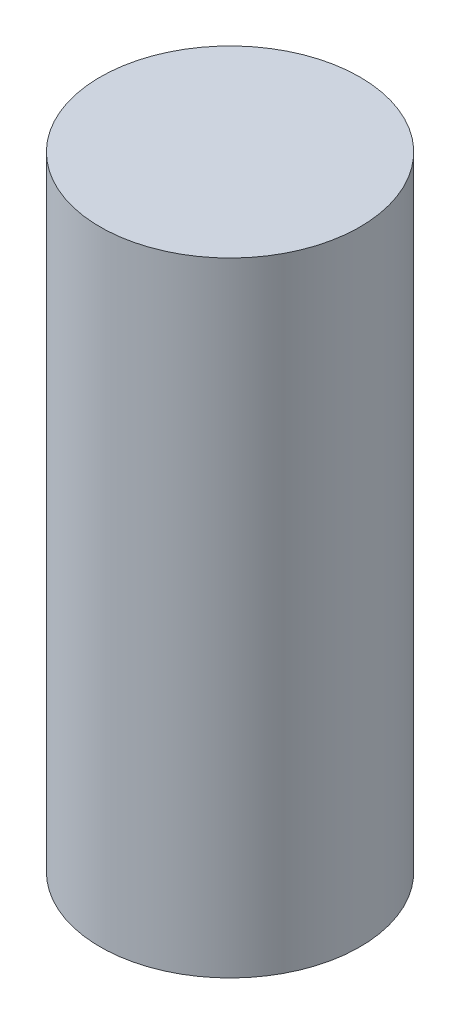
SolidWorks part; units mm, degrees
ref_plane "Front Plane" through (0, 0, 0) normal (0, 0, 1) x (1, 0, 0)
ref_plane "Top Plane" through (0, 0, 0) normal (0, 1, 0) x (1, 0, 0)
ref_plane "Right Plane" through (0, 0, 0) normal (1, 0, 0) x (0, 0, -1)
sketch "Sketch1" plane through (0, 0, 0) normal (0, 1, 0) x (1, 0, 0)
  circle A0 centre (0, 0) radius 7.9375
  point P0 (0, 0)
  dimension "D3" = 15.875
extrude "Block" add sketch "Sketch1" along normal blind 38.1 contours A0
other "Flex1" [suppressed] parameters "D0"=2, "D1"=0, "D2"=0
